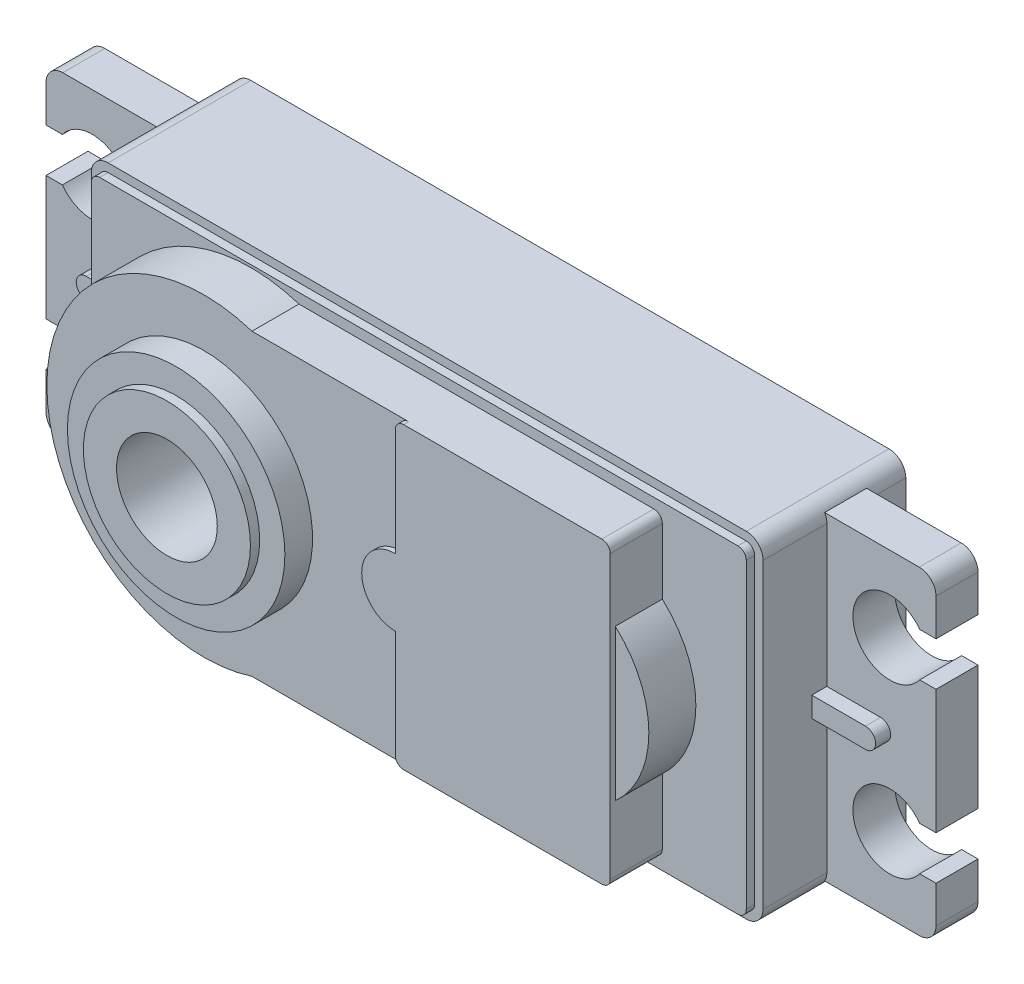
SolidWorks part; units mm, degrees
ref_plane "Přední" through (0, 0, 0) normal (0, 0, 1) x (1, 0, 0)
ref_plane "Horní" through (0, 0, 0) normal (0, 1, 0) x (1, 0, 0)
ref_plane "Pravá" through (0, 0, 0) normal (1, 0, 0) x (0, 0, -1)
sketch "Skica1" plane through (0, 0, 0) normal (0, 0, 1) x (1, 0, 0)
  line L4 (-19, -10) -> (19, -10)
  line L5 (20, -9) -> (20, 9)
  line L6 (19, 10) -> (-19, 10)
  line L7 (-20, 9) -> (-20, -9)
  line L8 (-19, -10) -> (19, -10)
  line L9 (20, -9) -> (20, 9)
  line L10 (19, 10) -> (-19, 10)
  line L11 (-20, 9) -> (-20, -9)
  arc A4 (-20, -9) -> (-19, -10) centre (-19, -9) ccw
  arc A5 (19, -10) -> (20, -9) centre (19, -9) ccw
  arc A6 (20, 9) -> (19, 10) centre (19, 9) ccw
  arc A7 (-19, 10) -> (-20, 9) centre (-19, 9) ccw
  arc A8 (-20, -9) -> (-19, -10) centre (-19, -9) ccw
  arc A9 (19, -10) -> (20, -9) centre (19, -9) ccw
  arc A10 (20, 9) -> (19, 10) centre (19, 9) ccw
  arc A11 (-19, 10) -> (-20, 9) centre (-19, 9) ccw
  dimension "D1" = 0
extrude "Základ-Protažení" add sketch "Skica1" along normal blind 8.5
sketch "Skica2" plane through (0, 0, 8.5) normal (0, 0, 1) x (1, 0, 0)
  line L8 (-19, -9.5) -> (19, -9.5)
  line L9 (19.5, -9) -> (19.5, 9)
  line L10 (19, 9.5) -> (-19, 9.5)
  line L11 (-19.5, 9) -> (-19.5, -9)
  line L12 (-19, -9.5) -> (19, -9.5)
  line L13 (19.5, -9) -> (19.5, 9)
  line L14 (19, 9.5) -> (-19, 9.5)
  line L15 (-19.5, 9) -> (-19.5, -9)
  arc A8 (-19.5, -9) -> (-19, -9.5) centre (-19, -9) ccw
  arc A9 (19, -9.5) -> (19.5, -9) centre (19, -9) ccw
  arc A10 (19.5, 9) -> (19, 9.5) centre (19, 9) ccw
  arc A11 (-19, 9.5) -> (-19.5, 9) centre (-19, 9) ccw
  arc A12 (-19.5, -9) -> (-19, -9.5) centre (-19, -9) ccw
  arc A13 (19, -9.5) -> (19.5, -9) centre (19, -9) ccw
  arc A14 (19.5, 9) -> (19, 9.5) centre (19, 9) ccw
  arc A15 (-19, 9.5) -> (-19.5, 9) centre (-19, 9) ccw
  dimension "D1" = 0.5
extrude "Přidání-Protažení1" add sketch "Skica2" along normal blind 0.5
sketch "Skica3" plane through (0, 0, 9) normal (0, 0, 1) x (1, 0, 0)
  line L0 (-19.5, 0) -> (19.5, 0) construction
  line L1 (-19.5, 9) -> (-19.5, -9) construction
  line L2 (19.5, -9) -> (19.5, 9) construction
  line L3 (-7.1343, 8.9) -> (14, 8.9)
  line L4 (-7.1343, -8.9) -> (14, -8.9)
  line L5 (14.5, 8.4) -> (14.5, 4.5)
  line L6 (16.5, 5.8264) -> (16.5, -5.8264) construction
  line L7 (14.5, -4.5) -> (14.5, -8.4)
  line L8 (-20, 9) -> (-20, -9) construction
  arc A0 (-7.1343, 8.9) -> (-7.1343, -8.9) centre (-10, 0) ccw
  arc A2 (14, 8.9) -> (14.5, 8.4) centre (14, 8.4) cw
  arc A3 (14.5, -4.5) -> (14.5, 4.5) centre (10.4375, 0) ccw
  arc A4 (14, -8.9) -> (14.5, -8.4) centre (14, -8.4) ccw
  point P20 (16.5, 0)
  point P21 (14.5, 8.9)
  point P24 (14.5, -8.9)
  dimension "D1" = 18.7
  dimension "D6" = 0.5
  dimension "D2" = 17.8
  dimension "D3" = 36
  dimension "D4" = 9
  dimension "D5" = 34
  dimension "D7" = 10
extrude "Přidání-Protažení2" add sketch "Skica3" along normal blind 2.8
sketch "Skica4" plane through (0, 0, 11.8) normal (0, 0, 1) x (1, 0, 0)
  line L0 (1.7, -8.4) -> (1.7, -2)
  line L1 (14.5, 0) -> (-1.3994, 0) construction
  line L2 (1.7, 2) -> (1.7, 8.4)
  line L4 (14, 8.9) -> (-7.1343, 8.9)
  line L5 (-7.1343, -8.9) -> (14, -8.9)
  line L6 (14.5, -8.4) -> (14.5, -4.5)
  line L7 (14.5, 4.5) -> (14.5, 8.4)
  line L8 (14, 8.9) -> (2.2, 8.9)
  line L9 (2.2, -8.9) -> (14, -8.9)
  line L10 (14.5, -8.4) -> (14.5, 8.4)
  arc A0 (1.7, -8.4) -> (2.2, -8.9) centre (2.2, -8.4) ccw
  arc A1 (1.7, 8.4) -> (2.2, 8.9) centre (2.2, 8.4) cw
  arc A2 (1.7, 2) -> (1.7, -2) centre (1.7, 0) ccw
  arc A4 (14.5, 8.4) -> (14, 8.9) centre (14, 8.4) ccw
  arc A5 (-7.1343, 8.9) -> (-7.1343, -8.9) centre (-10, 0) ccw
  arc A6 (14, -8.9) -> (14.5, -8.4) centre (14, -8.4) ccw
  arc A7 (14.5, -4.5) -> (14.5, 4.5) centre (10.4375, 0) ccw
  arc A8 (14.5, 8.4) -> (14, 8.9) centre (14, 8.4) ccw
  arc A10 (14, -8.9) -> (14.5, -8.4) centre (14, -8.4) ccw
  dimension "D2" = 12.8
  dimension "D3" = 4
  dimension "D1" = 0
extrude "Přidání-Protažení3" add sketch "Skica4" along normal blind 0.3
sketch "Skica5" plane through (0, 0, 11.8) normal (0, 0, 1) x (1, 0, 0)
  circle A0 centre (-10, 0) radius 6.475
  arc A1 (-7.1343, 8.9) -> (-7.1343, -8.9) centre (-10, 0) ccw construction
  dimension "D1" = 12.95
extrude "Přidání-Protažení5" add sketch "Skica5" along normal offset from surface (1.65 mm away) 13.45
sketch "Skica6" plane through (0, 0, 13.45) normal (0, 0, 1) x (1, 0, 0)
  circle A0 centre (-10, 0) radius 4.975
  dimension "D1" = 9.95
extrude "Přidání-Protažení6" add sketch "Skica6" along normal offset from surface (0.55 mm away) 14
sketch "Skica7" plane through (0, 0, 14) normal (0, 0, 1) x (1, 0, 0)
  circle A0 centre (-10, 0) radius 3
  dimension "D1" = 6
extrude "Odebrání-Protažení1" cut sketch "Skica7" against normal through all
ref_plane "Rovina1" through (0, 0, 2.2) normal (0, 0, -1) x (-1, 0, 0)
sketch "Skica8" plane through (0, 0, 2.2) normal (0, 0, -1) x (-1, 0, 0)
  line L0 (-22.8205, 0) -> (22.5128, 0) construction
  line L1 (19.866, 9.5) -> (25.5, 9.5)
  line L2 (19.866, -9.5) -> (25.5, -9.5)
  line L3 (26.5, 8.5) -> (26.5, 6.3)
  line L4 (25.5248, 6.3) -> (26.5, 6.3)
  line L5 (25.5248, -6.3) -> (26.5, -6.3)
  line L6 (25.5248, 3.7) -> (26.5, 3.7)
  line L7 (25.5248, -3.7) -> (26.5, -3.7)
  line L8 (21.5885, 5) -> (27.3455, 5) construction
  line L9 (21.5885, -5) -> (27.3455, -5) construction
  line L10 (26.5, 3.7) -> (26.5, -3.7)
  line L11 (26.5, -6.3) -> (26.5, -8.5)
  line L12 (19.866, 9.5) -> (19.866, -9.5)
  line L13 (0, 12.1276) -> (0, -12.1415) construction
  arc A0 (26.5, 8.5) -> (25.5, 9.5) centre (25.5, 8.5) ccw
  arc A1 (25.5, -9.5) -> (26.5, -8.5) centre (25.5, -8.5) ccw
  arc A2 (25.5248, 6.3) -> (25.5248, 3.7) centre (23.75, 5) ccw
  arc A3 (25.5248, -6.3) -> (25.5248, -3.7) centre (23.75, -5) cw
  arc A4 (20, 9) -> (19, 10) centre (19, 9) ccw construction
  point P11 (26.5, 9.5)
  point P14 (26.5, -9.5)
  dimension "D1" = 1
  dimension "D2" = 4.4
  dimension "D6" = 47.5
  dimension "D3" = 10
  dimension "D4" = 2.6
  dimension "D5" = 53
  dimension "D7" = 19
extrude "Přidání-Protažení7" add sketch "Skica8" against normal blind 2.5
sketch "Skica9" plane through (0, 0, 4.7) normal (0, 0, 1) x (1, 0, 0)
  line L0 (-20, 0) -> (-29.0207, 0) construction
  line L1 (-20, -9) -> (-20, 9) construction
  line L2 (-20, 0.6) -> (-23.2, 0.6)
  line L3 (-20, -0.6) -> (-23.2, -0.6)
  line L4 (-23.8, 0) -> (-23.8, -3.3472) construction
  line L5 (-20, 0.6) -> (-20, -0.6)
  arc A0 (-23.2, 0.6) -> (-23.2, -0.6) centre (-23.2, 0) ccw
  dimension "D1" = 1.2
  dimension "D2" = 23.8
extrude "Přidání-Protažení8" add sketch "Skica9" along normal blind 0.9
mirror "Zrcadlení1" about plane through (0, 0, 0) normal (1, 0, 0) of "Přidání-Protažení8", "Přidání-Protažení7"
